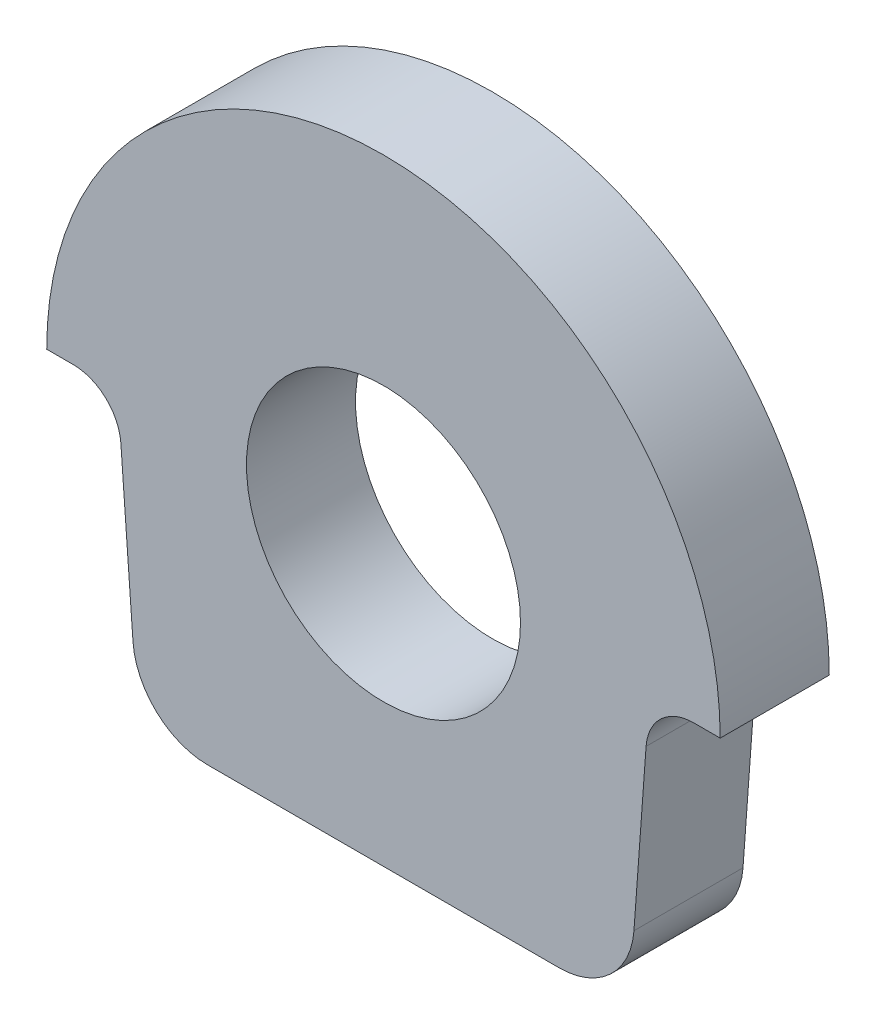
SolidWorks part; units mm, degrees
ref_plane "Plan de face" through (0, 0, 0) normal (0, 0, 1) x (1, 0, 0)
ref_plane "Plan de dessus" through (0, 0, 0) normal (0, 1, 0) x (1, 0, 0)
ref_plane "Plan de droite" through (0, 0, 0) normal (1, 0, 0) x (0, 0, -1)
sketch "Esquisse1" plane through (0, 0, 0) normal (0, 0, 1) x (1, 0, 0)
  line L0 (-12.8877, -20.5) -> (12.8877, -20.5)
  line L1 (18.3731, -15.4014) -> (19.2626, -3.2446)
  line L2 (22.7533, 0) -> (24.7, 0)
  line L3 (0, -20.5) -> (0, 24.7) construction
  line L4 (-22.7533, 0) -> (-24.7, 0)
  line L5 (-18.3731, -15.4014) -> (-19.2626, -3.2446)
  circle A0 centre (0, 0) radius 10.05
  arc A1 (24.7, 0) -> (-24.7, 0) centre (0, 0) ccw
  arc A2 (18.3731, -15.4014) -> (12.8877, -20.5) centre (12.8877, -15) cw
  arc A3 (22.7533, 0) -> (19.2626, -3.2446) centre (22.7533, -3.5) ccw
  arc A4 (-22.7533, 0) -> (-19.2626, -3.2446) centre (-22.7533, -3.5) cw
  arc A5 (-18.3731, -15.4014) -> (-12.8877, -20.5) centre (-12.8877, -15) ccw
  point P10 (18, -20.5)
  point P13 (19.5, 0)
  point P21 (-19.5, 0)
  point P22 (-18, -20.5)
  dimension "D2" = 20.1
  dimension "D3" = 24.7
  dimension "D6" = 5.5
  dimension "D7" = 3.5
  dimension "D1" = 20.5
  dimension "D4" = 36
  dimension "D5" = 39
extrude "Extrusion1" add sketch "Esquisse1" along normal blind 8
